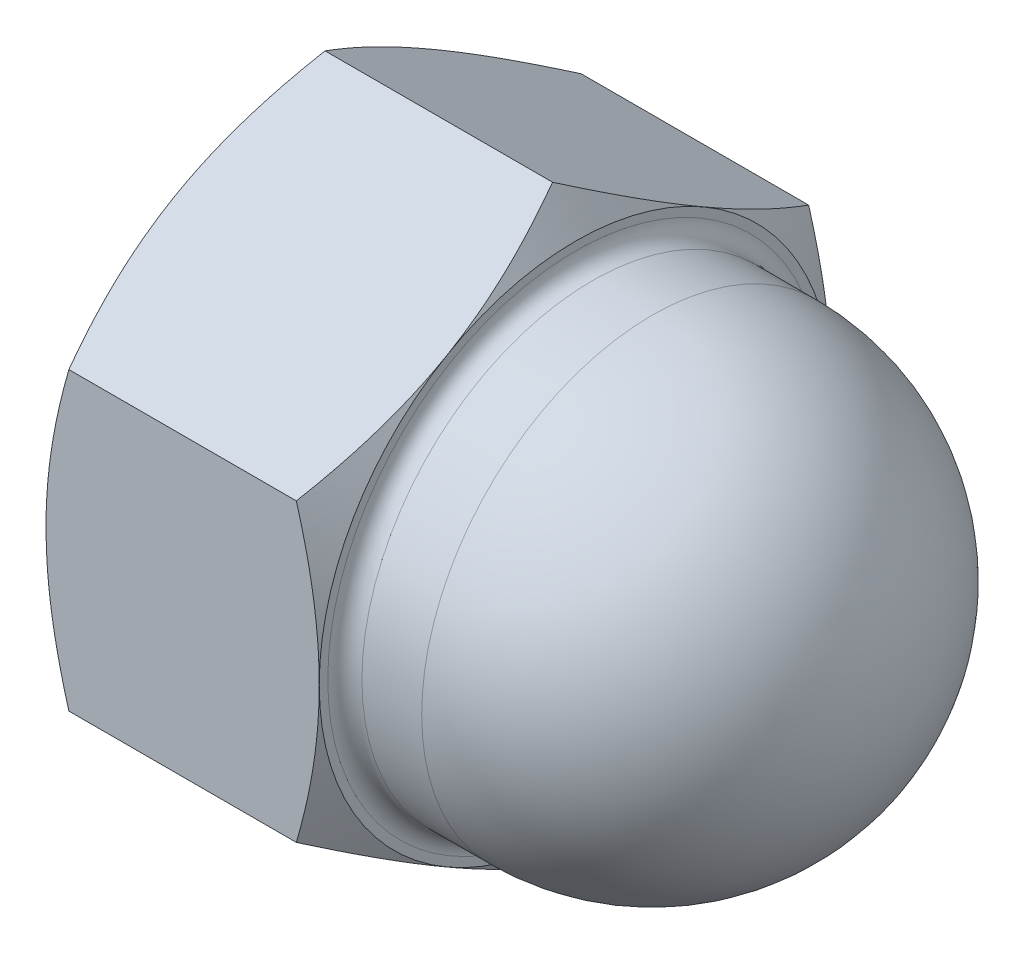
SolidWorks part; units mm, degrees
ref_plane "Plane1" through (0, 0, 0) normal (0, 0, 1) x (1, 0, 0)
ref_plane "Plane2" through (0, 0, 0) normal (0, 1, 0) x (1, 0, 0)
ref_plane "Plane3" through (0, 0, 0) normal (1, 0, 0) x (0, 0, -1)
sketch "BaseNutSke" plane through (0, 0, 0) normal (1, 0, 0) x (0, 0, -1)
  line L6 (15, 8.6603) -> (15, -8.6603)
  line L7 (-15, 8.6603) -> (-15, -8.6603)
  line L8 (15, 8.6603) -> (0, 17.3205)
  line L9 (0, 17.3205) -> (-15, 8.6603)
  line L10 (-15, -8.6603) -> (0, -17.3205)
  line L11 (0, -17.3205) -> (15, -8.6603)
  dimension "D4" = 60
  dimension "D1" = 120
  dimension "D2" = 15
  dimension "D3" = 15
  dimension "Width_flats" = 30
extrude "BaseNut" add sketch "BaseNutSke" along normal blind 16
sketch "DomeSke" plane through (0, 0, 0) normal (0, 0, 1) x (1, 0, 0)
  line L0 (0, 0) -> (63.5, 0) construction
  line L1 (0, 8.6603) -> (0, -8.6603) construction
  line L2 (34, 0) -> (0, 0)
  line L3 (0, 13.5) -> (20.5, 13.5)
  line L4 (0, -13.5) -> (22.225, -13.5) construction
  line L5 (0, 13.5) -> (0, 0)
  arc A0 (20.5, 13.5) -> (34, 0) centre (20.5, 0) cw
  dimension "Dome_rad" = 13.5
  dimension "Overall_ht" = 34
revolve "Dome" add sketch "DomeSke" angle 360 about L0
sketch "Sketch4" plane through (0, 0, 0) normal (0, 0, 1) x (1, 0, 0)
  line L0 (0, 15) -> (2.7831, 19.8205)
  line L1 (16, 15) -> (13.2169, 19.8205)
  line L2 (2.7831, 19.8205) -> (13.2169, 19.8205)
  line L3 (16, 15) -> (18, 15)
  line L4 (18, 15) -> (18, 30)
  line L5 (18, 30) -> (-2, 30)
  line L6 (0, 15) -> (-2, 15)
  line L7 (-2, 15) -> (-2, 30)
  line L8 (16, 17.3205) -> (16, 8.6603) construction
  line L9 (0, 17.3205) -> (0, 8.6603) construction
  line L10 (0, 0) -> (57.15, 0) construction
  line L11 (16, 17.3205) -> (0, 17.3205) construction
  point P17 (16, 15)
  dimension "D1" = 30
  dimension "D2" = 30
  dimension "D3" = 2
  dimension "D4" = 2
  dimension "D5" = 2.5
  dimension "D6" = 15
  dimension "D7" = 15
revolve "DoubleChamfer" cut sketch "Sketch4" angle 360 about L10
sketch "TapDriSke" plane through (0, 0, 0) normal (0, 0, 1) x (1, 0, 0)
  line L0 (0, 0) -> (44.45, 0) construction
  line L1 (0, 8.75) -> (27, 8.75)
  line L2 (0, 12.9904) -> (0, 0) construction
  line L3 (27, 8.75) -> (32.2575, 0)
  line L4 (0, 0) -> (63.5, 0) construction
  line L5 (32.2575, 0) -> (0, 0)
  line L6 (0, 0) -> (0, 8.75)
  line L7 (27, -8.75) -> (32.2575, 0) construction
  line L8 (0, -8.75) -> (27, -8.75) construction
  line L9 (0.5, 6.35) -> (0.5, 3.175) construction
  dimension "TPA" = 118
  dimension "Thread_min" = 17.5
  dimension "Drill_depth" = 27
  dimension "Drill_clr" = 1
revolve "TapDrill" cut sketch "TapDriSke"
revolve "EndChamfer" cut sketch "EndChamferSketch" angle 360 about L4
sketch "EndChamferSketch" plane through (0, 0, 0) normal (0, 0, 1) x (1, 0, 0)
  line L0 (-0.0254, 10) -> (0.0254, 10)
  line L1 (0.0254, 10) -> (0.9882, 8.625)
  line L2 (0.9882, 8.625) -> (-0.0254, 8.625)
  line L3 (-0.0254, 8.625) -> (-0.0254, 10)
  line L4 (0, 0) -> (-15.875, 0) construction
  dimension "D1" = 0.0508
  dimension "D2" = 35
  dimension "D3" = 0.0254
  dimension "ChamferDepth" = 1.375
  dimension "ThreadMajor" = 10
sketch "ThdSchSke" plane through (0, 0, 0) normal (0, 1, 0) x (1, 0, 0)
  line L0 (0.0381, 10) -> (-0.8372, 8.75)
  line L1 (-0.8372, 8.75) -> (-0.8372, 4.375)
  line L2 (-0.8372, 4.375) -> (0.9134, 4.375)
  line L3 (0.9134, 4.375) -> (0.9134, 8.75)
  line L4 (0.9134, 8.75) -> (0.0381, 10)
  line L5 (-38.1, 0) -> (3.175, 0) construction
  line L6 (0, 0) -> (-15.875, 0) construction
  line L7 (0, 0) -> (63.5, 0) construction
  line L9 (2.5381, 0.475) -> (2.5381, -5.875) construction
  dimension "D1" = 0.0381
  dimension "VeeAngle" = 70
  dimension "SideAngle" = 55
  dimension "Thread_major" = 20
  dimension "Tap_drill" = 17.5
  dimension "OverCut" = 8.75
  dimension "Advance" = 2.5
revolve "ThreadSchematic" [suppressed] cut sketch "ThdSchSke" angle 360 about L5
pattern_linear "ThdSchPat" [suppressed]
fillet "DomeFillet" radius 1 1 edges at (16, 0, 13.5)
equation "' \"Width_flats@BaseNutSke\" = 30"
equation "' \"Hex_ht@BaseNut\" = 16"
equation "' \"Overall_ht@DomeSke\" = 34"
equation "' \"Dome_rad@DomeSke\" = 13.5"
equation "' \"Thread_min@TapDriSke\" = 17.5"
equation "' \"Drill_clr@TapDriSke\" = 1.0"
equation "' \"Advance@ThdSchSke\" = 2.5"
equation "' \"Thread_nominal@ThreadCosmetic\" = 20"
equation "' \"Thread_depth@ThreadCosmetic\" = 20"
equation "' \"Radius@DomeFillet\" = 1.0"
equation "\"Drill_depth@TapDriSke\" = \"Overall_ht@DomeSke\"  - \"Drill_clr@TapDriSke\" - 0.3 * \"Thread_nominal@ThreadCosmetic\""
equation "\"D2@BaseNutSke\" = \"Width_flats@BaseNutSke\" / 2"
equation "\"D3@BaseNutSke\" = \"Width_flats@BaseNutSke\" / 2"
equation "\"D7@Sketch4\" = \"Width_flats@BaseNutSke\" / 2"
equation "\"D5@Sketch4\" = \"Width_flats@BaseNutSke\" / 12"
equation "\"Thread_major@ThdSchSke\" = \"Thread_nominal@ThreadCosmetic\""
equation "\"Tap_drill@ThdSchSke\" = \"Thread_min@TapDriSke\""
equation "\"Overcut@ThdSchSke\" = \"Tap_drill@ThdSchSke\" * 0.5"
equation "' \"Num_threads@ThdSchPat\" = int(  ( \"Hex_ht@BaseNut\" - 0.002 ) / \"Advance@ThdSchSke\" + 0.999 )  + 1"
equation "\"Num_threads@ThdSchPat\" = int(  ( \"Thread_depth@ThreadCosmetic\" - 0.002 ) / \"Advance@ThdSchSke\" + 0.999 )  + 1"
equation "' \"Advance@ThdSchPat\" = ( \"Hex_ht@BaseNut\" - 0.002 ) /  (\"Num_threads@ThdSchPat\" - 1) 'relax it"
equation "\"Advance@ThdSchPat\" = ( \"Thread_depth@ThreadCosmetic\" - 0.002 ) /  (\"Num_threads@ThdSchPat\" - 1) 'relax it"
equation "\"ThreadMajor@EndChamferSketch\" = \"Thread_nominal@ThreadCosmetic\" * 0.5"
equation "\"ChamferDepth@EndChamferSketch\" = (\"Thread_nominal@ThreadCosmetic\" - \"Thread_min@TapDriSke\") * 0.55"
